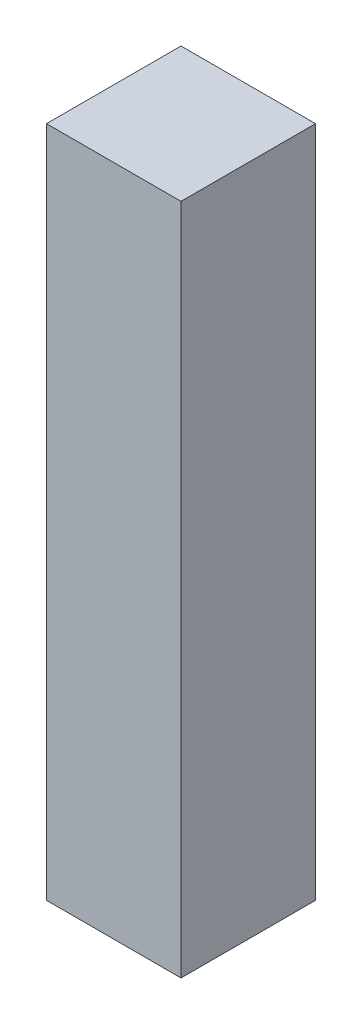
SolidWorks part; units mm, degrees
ref_plane "前视基准面" through (0, 0, 0) normal (0, 0, 1) x (1, 0, 0)
ref_plane "上视基准面" through (0, 0, 0) normal (0, 1, 0) x (1, 0, 0)
ref_plane "右视基准面" through (0, 0, 0) normal (1, 0, 0) x (0, 0, -1)
other "Configuration Table"
sketch "草图1" plane through (0, 0, 0) normal (0, 1, 0) x (1, 0, 0)
  line L1 (-30, 30) -> (30, 30)
  line L2 (-30, 30) -> (-30, -30)
  line L3 (-30, -30) -> (30, -30)
  line L4 (30, 30) -> (30, -30)
  line L5 (-30, 30) -> (30, -30) construction
  line L6 (-30, -30) -> (30, 30) construction
  point P0 (0, 0)
extrude "凸台-拉伸1" add sketch "草图1" along normal blind 300
sketch "草图2" plane through (0, 0, 30) normal (0, 0, 1) x (1, 0, 0)
  line L0 (-30, 60) -> (30, 60)
  line L1 (-30, 300) -> (-30, 0) construction
  line L2 (30, 300) -> (30, 0) construction
  line L3 (-30, 0) -> (30, 0) construction
  line L4 (-30, 240) -> (30, 240)
  line L5 (-30, 300) -> (30, 300) construction
  dimension "D1" = 60
  dimension "D2" = 60
sketch "草图4" plane through (0, 0, 30) normal (0, 0, 1) x (1, 0, 0)
  line L0 (0, 240) -> (0, 60)
  line L1 (-30, 240) -> (30, 240) construction
  line L2 (-30, 60) -> (30, 60) construction
